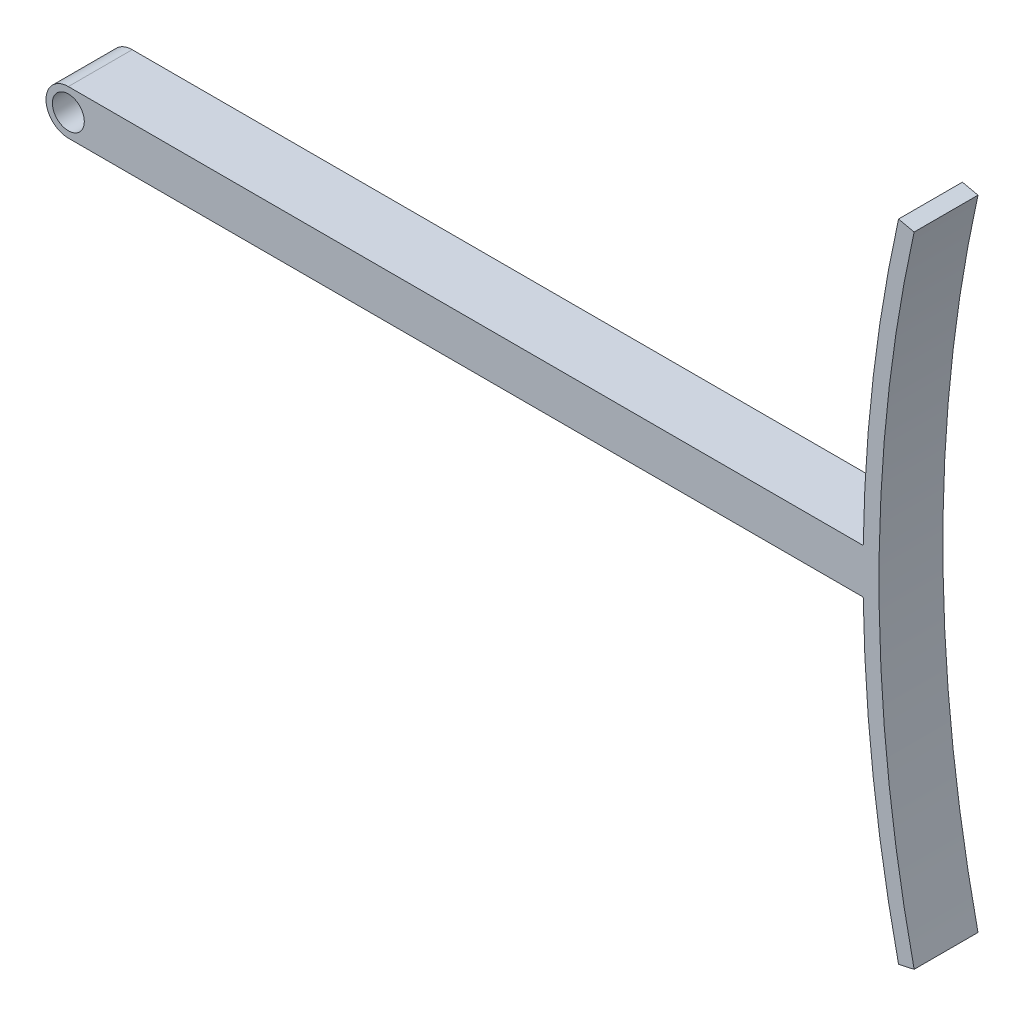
SolidWorks part; units mm, degrees
ref_plane "Face" through (0, 0, 0) normal (0, 0, 1) x (1, 0, 0)
ref_plane "Dessus" through (0, 0, 0) normal (0, 1, 0) x (1, 0, 0)
ref_plane "Droite" through (0, 0, 0) normal (1, 0, 0) x (0, 0, -1)
sketch "Esquisse1" plane through (0, 0, 0) normal (0, 0, 1) x (1, 0, 0)
  line L0 (0, -7) -> (248.9627, -7)
  line L1 (260.0307, 101.087) -> (264.9111, 100)
  line L2 (0, 7) -> (248.9627, 7)
  line L3 (260.0307, -101.087) -> (264.9111, -100)
  arc A0 (0, 7) -> (0, -7) centre (0, 0) ccw
  arc A1 (264.9111, 100) -> (264.9111, -100) centre (713.91, 0) ccw
  arc A2 (260.0307, 101.087) -> (248.9627, 7) centre (713.91, 0) ccw
  arc A3 (248.9627, -7) -> (260.0307, -101.087) centre (713.91, 0) ccw
  arc A4 (260.0307, 101.087) -> (260.0307, -101.087) centre (713.91, 0) ccw construction
  circle A5 centre (0, 0) radius 5
  dimension "D1" = 14
  dimension "D2" = 920
  dimension "D3" = 713.91
  dimension "D4" = 5
extrude "Extrusion1" add sketch "Esquisse1" along normal mid plane 20
